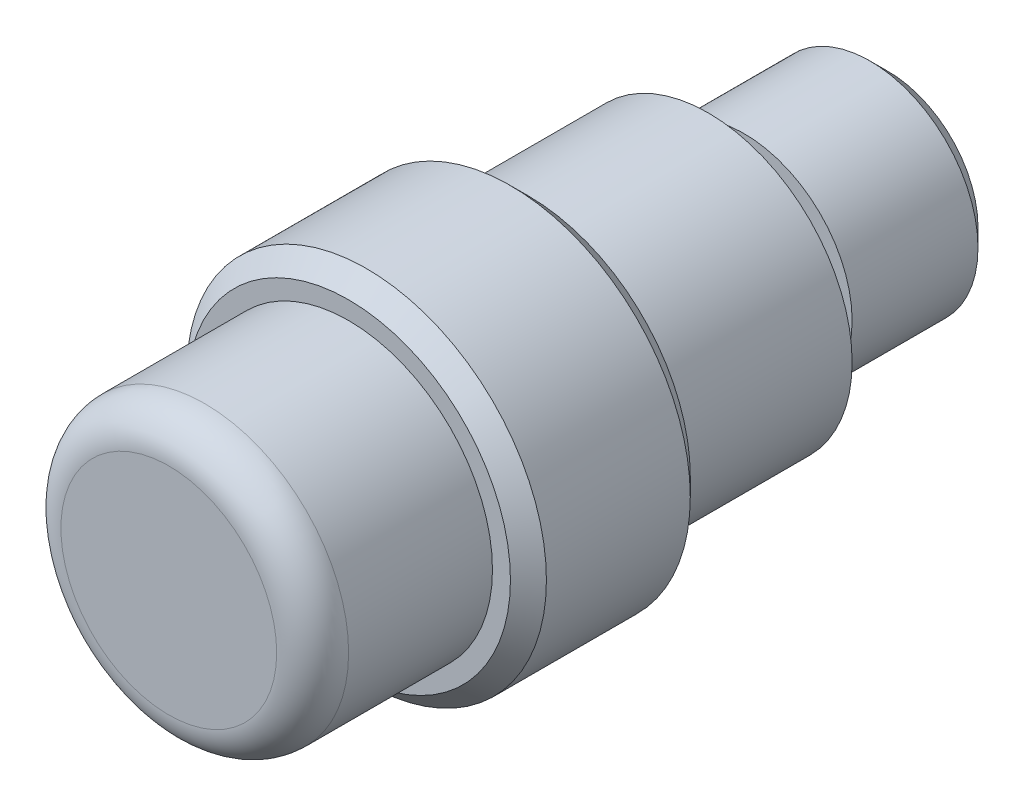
SolidWorks part; units mm, degrees
ref_plane "前视基准面" through (0, 0, 0) normal (0, 0, 1) x (1, 0, 0)
ref_plane "上视基准面" through (0, 0, 0) normal (0, 1, 0) x (1, 0, 0)
ref_plane "右视基准面" through (0, 0, 0) normal (1, 0, 0) x (0, 0, -1)
sketch "草图1" plane through (0, 0, 0) normal (0, 0, 1) x (1, 0, 0)
  circle A0 centre (0, 0) radius 6
  dimension "D1" = 12
extrude "凸台-拉伸1" add sketch "草图1" along normal blind 8
sketch "草图2" plane through (0, 0, 8) normal (0, 0, 1) x (1, 0, 0)
  circle A0 centre (0, 0) radius 5
  dimension "D1" = 10
extrude "凸台-拉伸2" add sketch "草图2" along normal blind 2
sketch "草图3" plane through (0, 0, 10) normal (0, 0, 1) x (1, 0, 0)
  circle A0 centre (0, 0) radius 8
  dimension "D1" = 16
extrude "凸台-拉伸3" add sketch "草图3" along normal blind 10
chamfer "倒角1" distance 1 angle 45 1 edges at (6, 0, 0)
sketch "草图4" plane through (0, 0, 20) normal (0, 0, 1) x (1, 0, 0)
  circle A1 centre (0, 0) radius 10
  dimension "D1" = 20
extrude "凸台-拉伸4" add sketch "草图4" along normal blind 10
sketch "草图5" plane through (0, 0, 30) normal (0, 0, 1) x (1, 0, 0)
  circle A0 centre (0, 0) radius 8
  dimension "D1" = 16
extrude "凸台-拉伸5" add sketch "草图5" along normal blind 10
fillet "圆角1" radius 2 1 edges at (8, 0, 40)
chamfer "倒角2" distance 1 2 edges at (10, 0, 20) (10, 0, 30)
